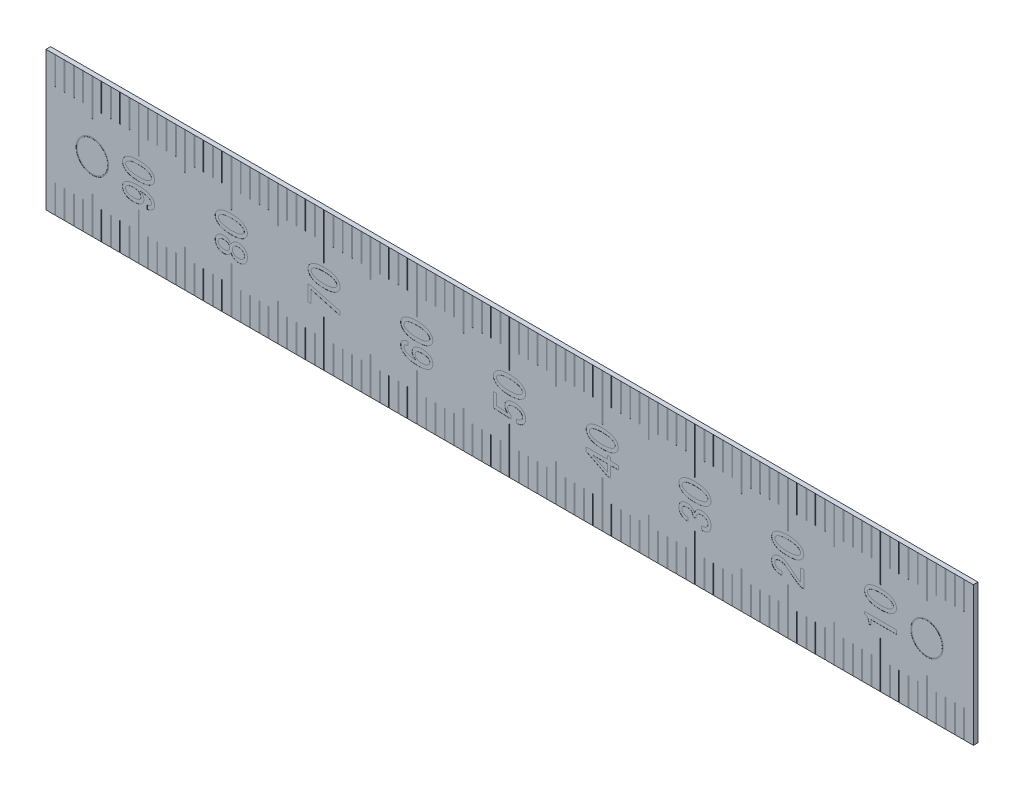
SolidWorks part; units mm, degrees
ref_plane "Front" through (0, 0, 0) normal (0, 0, 1) x (1, 0, 0)
ref_plane "Top" through (0, 0, 0) normal (0, 1, 0) x (1, 0, 0)
ref_plane "Right" through (0, 0, 0) normal (1, 0, 0) x (0, 0, -1)
sketch "Sketch1" plane through (0, 0, 0) normal (0, 0, 1) x (1, 0, 0)
  line L1 (0, -50) -> (0, 50)
  line L2 (0, -50) -> (15, -50)
  line L3 (15, -50) -> (15, 50)
  line L4 (0, 50) -> (15, 50)
  dimension "D1" = 100
  dimension "D2" = 15
extrude "Extrude1" add sketch "Sketch1" along normal blind 0.5
sketch "Sketch2" plane through (0, 0, 0.5) normal (0, 0, 1) x (1, 0, 0)
  line L0 (0, 50) -> (0, -50) construction
  line L1 (0, -50) -> (15, -50) construction
  line L2 (15, 50) -> (0, 50) construction
  circle A0 centre (7.5, -45) radius 1.75
  circle A1 centre (7.5, 45) radius 1.75
  circle A2 centre (7.5, -45) radius 1.65
  circle A3 centre (7.5, 45) radius 1.65
  dimension "D1" = 7.5
  dimension "D2" = 7.5
  dimension "D3" = 5
  dimension "D4" = 5
  dimension "D5" = 3.5
  dimension "D6" = 3.5
  dimension "D7" = 0.1
extrude "Extrude2" cut sketch "Sketch2" against normal blind 0.01
sketch "Sketch3" plane through (0, 0, 0.5) normal (0, 0, 1) x (1, 0, 0)
  line L0 (15, 50) -> (0, 50) construction
  line L1 (5.25, 28.25) -> (9.75, 28.25) construction
  line L2 (5.25, 18.25) -> (9.75, 18.25) construction
  line L3 (5.25, 8.25) -> (9.75, 8.25) construction
  line L5 (0, 50) -> (0, -50) construction
  line L6 (5.25, -1.75) -> (9.75, -1.75) construction
  line L7 (5.25, 38.25) -> (9.75, 38.25) construction
  line L8 (5.25, 38.25) -> (5.25, 41.75) construction
  line L9 (7.5, -50) -> (7.5, 50) construction
  line L10 (0, -50) -> (15, -50) construction
  line L11 (0, 40) -> (15, 40) construction
  line L12 (15, -50) -> (15, 50) construction
  line L13 (5.25, 41.75) -> (9.75, 41.75) construction
  line L14 (9.75, 38.25) -> (9.75, 41.75) construction
  line L15 (5.25, 38.25) -> (9.75, 41.75) construction
  line L16 (5.25, 41.75) -> (9.75, 38.25) construction
  line L17 (5.25, -11.75) -> (9.75, -11.75) construction
  line L18 (5.25, -21.75) -> (9.75, -21.75) construction
  line L19 (5.25, -31.75) -> (9.75, -31.75) construction
  line L20 (5.25, -41.75) -> (9.75, -41.75) construction
  circle A0 centre (7.5, 45) radius 1.75 construction
  text T0 "90" font "ＭＳ ゴシック" height 3.5
  text T1 "80" font "ＭＳ ゴシック" height 3.5
  text T2 "70" font "ＭＳ ゴシック" height 3.5
  text T3 "60" font "ＭＳ ゴシック" height 3.5
  text T4 "50  "
  text T5 "40"
  text T6 "30"
  text T7 "20"
  text T8 "10"
  point P7 (7.5, 40)
  dimension "D2" = 7.5
  dimension "D1" = 4
  dimension "D3" = 6
  dimension "D6" = 10
  dimension "D5" = 4.5
  dimension "D7" = 3.5
extrude "Extrude3" cut sketch "Sketch3" against normal blind 0.01
sketch "Sketch4" plane through (0, 0, 0.5) normal (0, 0, 1) x (1, 0, 0)
  line L0 (15, 40.05) -> (10, 40.05)
  line L1 (15, -50) -> (15, 50) construction
  line L2 (10, 40.05) -> (10, 39.95)
  line L3 (10, 39.95) -> (15, 39.95)
  line L4 (15, 39.95) -> (15, 40.05)
  line L5 (15, 50) -> (0, 50) construction
  line L6 (15, 48.05) -> (15, 47.95)
  line L7 (15, 44.95) -> (11, 44.95)
  line L8 (15, 44.95) -> (15, 45.05)
  line L9 (15, 45.05) -> (11, 45.05)
  line L10 (11, 44.95) -> (11, 45.05)
  line L11 (15, 49.05) -> (12, 49.05)
  line L12 (15, 49.05) -> (15, 48.95)
  line L13 (15, 48.95) -> (12, 48.95)
  line L14 (12, 49.05) -> (12, 48.95)
  line L15 (15, 48.05) -> (12, 48.05)
  line L16 (15, 47.95) -> (12, 47.95)
  line L17 (12, 48.05) -> (12, 47.95)
  line L18 (15, 47.05) -> (15, 46.95)
  line L19 (15, 47.05) -> (12, 47.05)
  line L20 (15, 46.95) -> (12, 46.95)
  line L21 (12, 47.05) -> (12, 46.95)
  line L22 (15, 46.05) -> (15, 45.95)
  line L23 (15, 46.05) -> (12, 46.05)
  line L24 (15, 45.95) -> (12, 45.95)
  line L25 (12, 46.05) -> (12, 45.95)
  line L26 (15, 30.05) -> (10, 30.05)
  line L27 (10, 30.05) -> (10, 29.95)
  line L28 (10, 29.95) -> (15, 29.95)
  line L29 (15, 29.95) -> (15, 30.05)
  line L30 (15, 44.05) -> (15, 43.95)
  line L31 (15, 44.05) -> (12, 44.05)
  line L32 (15, 43.95) -> (12, 43.95)
  line L33 (12, 44.05) -> (12, 43.95)
  line L34 (15, 43.05) -> (15, 42.95)
  line L35 (15, 43.05) -> (12, 43.05)
  line L36 (15, 42.95) -> (12, 42.95)
  line L37 (12, 43.05) -> (12, 42.95)
  line L38 (15, 42.05) -> (15, 41.95)
  line L39 (15, 42.05) -> (12, 42.05)
  line L40 (15, 41.95) -> (12, 41.95)
  line L41 (12, 42.05) -> (12, 41.95)
  line L42 (15, 41.05) -> (15, 40.95)
  line L43 (15, 41.05) -> (12, 41.05)
  line L44 (15, 40.95) -> (12, 40.95)
  line L45 (12, 41.05) -> (12, 40.95)
  line L46 (12, 45.05) -> (12, 44.95)
  line L47 (15, 45.05) -> (12, 45.05)
  line L48 (15, 44.95) -> (12, 44.95)
  line L49 (15, 45.05) -> (15, 44.95)
  line L50 (15, 38.05) -> (15, 37.95)
  line L51 (15, 34.95) -> (11, 34.95)
  line L52 (15, 34.95) -> (15, 35.05)
  line L53 (15, 35.05) -> (11, 35.05)
  line L54 (11, 34.95) -> (11, 35.05)
  line L55 (15, 39.05) -> (12, 39.05)
  line L56 (15, 39.05) -> (15, 38.95)
  line L57 (15, 38.95) -> (12, 38.95)
  line L58 (12, 39.05) -> (12, 38.95)
  line L59 (15, 38.05) -> (12, 38.05)
  line L60 (15, 37.95) -> (12, 37.95)
  line L61 (12, 38.05) -> (12, 37.95)
  line L62 (15, 37.05) -> (15, 36.95)
  line L63 (15, 37.05) -> (12, 37.05)
  line L64 (15, 36.95) -> (12, 36.95)
  line L65 (12, 37.05) -> (12, 36.95)
  line L66 (15, 36.05) -> (15, 35.95)
  line L67 (15, 36.05) -> (12, 36.05)
  line L68 (15, 35.95) -> (12, 35.95)
  line L69 (12, 36.05) -> (12, 35.95)
  line L70 (15, 34.05) -> (15, 33.95)
  line L71 (15, 34.05) -> (12, 34.05)
  line L72 (15, 33.95) -> (12, 33.95)
  line L73 (12, 34.05) -> (12, 33.95)
  line L74 (15, 33.05) -> (15, 32.95)
  line L75 (15, 33.05) -> (12, 33.05)
  line L76 (15, 32.95) -> (12, 32.95)
  line L77 (12, 33.05) -> (12, 32.95)
  line L78 (15, 32.05) -> (15, 31.95)
  line L79 (15, 32.05) -> (12, 32.05)
  line L80 (15, 31.95) -> (12, 31.95)
  line L81 (12, 32.05) -> (12, 31.95)
  line L82 (15, 31.05) -> (15, 30.95)
  line L83 (15, 31.05) -> (12, 31.05)
  line L84 (15, 30.95) -> (12, 30.95)
  line L85 (12, 31.05) -> (12, 30.95)
  line L86 (15, 20.05) -> (10, 20.05)
  line L87 (10, 20.05) -> (10, 19.95)
  line L88 (10, 19.95) -> (15, 19.95)
  line L89 (15, 19.95) -> (15, 20.05)
  line L90 (15, 28.05) -> (15, 27.95)
  line L91 (15, 24.95) -> (11, 24.95)
  line L92 (15, 24.95) -> (15, 25.05)
  line L93 (15, 25.05) -> (11, 25.05)
  line L94 (11, 24.95) -> (11, 25.05)
  line L95 (15, 29.05) -> (12, 29.05)
  line L96 (15, 29.05) -> (15, 28.95)
  line L97 (15, 28.95) -> (12, 28.95)
  line L98 (12, 29.05) -> (12, 28.95)
  line L99 (15, 28.05) -> (12, 28.05)
  line L100 (15, 27.95) -> (12, 27.95)
  line L101 (12, 28.05) -> (12, 27.95)
  line L102 (15, 27.05) -> (15, 26.95)
  line L103 (15, 27.05) -> (12, 27.05)
  line L104 (15, 26.95) -> (12, 26.95)
  line L105 (12, 27.05) -> (12, 26.95)
  line L106 (15, 26.05) -> (15, 25.95)
  line L107 (15, 26.05) -> (12, 26.05)
  line L108 (15, 25.95) -> (12, 25.95)
  line L109 (12, 26.05) -> (12, 25.95)
  line L110 (15, 24.05) -> (15, 23.95)
  line L111 (15, 24.05) -> (12, 24.05)
  line L112 (15, 23.95) -> (12, 23.95)
  line L113 (12, 24.05) -> (12, 23.95)
  line L114 (15, 23.05) -> (15, 22.95)
  line L115 (15, 23.05) -> (12, 23.05)
  line L116 (15, 22.95) -> (12, 22.95)
  line L117 (12, 23.05) -> (12, 22.95)
  line L118 (15, 22.05) -> (15, 21.95)
  line L119 (15, 22.05) -> (12, 22.05)
  line L120 (15, 21.95) -> (12, 21.95)
  line L121 (12, 22.05) -> (12, 21.95)
  line L122 (15, 21.05) -> (15, 20.95)
  line L123 (15, 21.05) -> (12, 21.05)
  line L124 (15, 20.95) -> (12, 20.95)
  line L125 (12, 21.05) -> (12, 20.95)
  line L126 (15, 10.05) -> (10, 10.05)
  line L127 (10, 10.05) -> (10, 9.95)
  line L128 (10, 9.95) -> (15, 9.95)
  line L129 (15, 9.95) -> (15, 10.05)
  line L130 (15, 18.05) -> (15, 17.95)
  line L131 (15, 14.95) -> (11, 14.95)
  line L132 (15, 14.95) -> (15, 15.05)
  line L133 (15, 15.05) -> (11, 15.05)
  line L134 (11, 14.95) -> (11, 15.05)
  line L135 (15, 19.05) -> (12, 19.05)
  line L136 (15, 19.05) -> (15, 18.95)
  line L137 (15, 18.95) -> (12, 18.95)
  line L138 (12, 19.05) -> (12, 18.95)
  line L139 (15, 18.05) -> (12, 18.05)
  line L140 (15, 17.95) -> (12, 17.95)
  line L141 (12, 18.05) -> (12, 17.95)
  line L142 (15, 17.05) -> (15, 16.95)
  line L143 (15, 17.05) -> (12, 17.05)
  line L144 (15, 16.95) -> (12, 16.95)
  line L145 (12, 17.05) -> (12, 16.95)
  line L146 (15, 16.05) -> (15, 15.95)
  line L147 (15, 16.05) -> (12, 16.05)
  line L148 (15, 15.95) -> (12, 15.95)
  line L149 (12, 16.05) -> (12, 15.95)
  line L150 (15, 14.05) -> (15, 13.95)
  line L151 (15, 14.05) -> (12, 14.05)
  line L152 (15, 13.95) -> (12, 13.95)
  line L153 (12, 14.05) -> (12, 13.95)
  line L154 (15, 13.05) -> (15, 12.95)
  line L155 (15, 13.05) -> (12, 13.05)
  line L156 (15, 12.95) -> (12, 12.95)
  line L157 (12, 13.05) -> (12, 12.95)
  line L158 (15, 12.05) -> (15, 11.95)
  line L159 (15, 12.05) -> (12, 12.05)
  line L160 (15, 11.95) -> (12, 11.95)
  line L161 (12, 12.05) -> (12, 11.95)
  line L162 (15, 11.05) -> (15, 10.95)
  line L163 (15, 11.05) -> (12, 11.05)
  line L164 (15, 10.95) -> (12, 10.95)
  line L165 (12, 11.05) -> (12, 10.95)
  line L166 (7.5, 50) -> (7.5, 36.693) construction
  line L167 (3, 1.05) -> (3, 0.95)
  line L168 (0, 0.95) -> (3, 0.95)
  line L169 (0, 1.05) -> (3, 1.05)
  line L170 (15, 8.05) -> (15, 7.95)
  line L171 (15, 4.95) -> (11, 4.95)
  line L172 (15, 4.95) -> (15, 5.05)
  line L173 (15, 5.05) -> (11, 5.05)
  line L174 (11, 4.95) -> (11, 5.05)
  line L175 (15, 9.05) -> (12, 9.05)
  line L176 (15, 9.05) -> (15, 8.95)
  line L177 (15, 8.95) -> (12, 8.95)
  line L178 (12, 9.05) -> (12, 8.95)
  line L179 (15, 8.05) -> (12, 8.05)
  line L180 (15, 7.95) -> (12, 7.95)
  line L181 (12, 8.05) -> (12, 7.95)
  line L182 (15, 7.05) -> (15, 6.95)
  line L183 (15, 7.05) -> (12, 7.05)
  line L184 (15, 6.95) -> (12, 6.95)
  line L185 (12, 7.05) -> (12, 6.95)
  line L186 (15, 6.05) -> (15, 5.95)
  line L187 (15, 6.05) -> (12, 6.05)
  line L188 (15, 5.95) -> (12, 5.95)
  line L189 (12, 6.05) -> (12, 5.95)
  line L190 (15, 4.05) -> (15, 3.95)
  line L191 (15, 4.05) -> (12, 4.05)
  line L192 (15, 3.95) -> (12, 3.95)
  line L193 (12, 4.05) -> (12, 3.95)
  line L194 (15, 3.05) -> (15, 2.95)
  line L195 (15, 3.05) -> (12, 3.05)
  line L196 (15, 2.95) -> (12, 2.95)
  line L197 (12, 3.05) -> (12, 2.95)
  line L198 (15, 2.05) -> (15, 1.95)
  line L199 (15, 2.05) -> (12, 2.05)
  line L200 (15, 1.95) -> (12, 1.95)
  line L201 (12, 2.05) -> (12, 1.95)
  line L202 (15, 1.05) -> (15, 0.95)
  line L203 (15, 1.05) -> (12, 1.05)
  line L204 (15, 0.95) -> (12, 0.95)
  line L205 (12, 1.05) -> (12, 0.95)
  line L206 (15, 0.05) -> (10, 0.05)
  line L207 (10, 0.05) -> (10, -0.05)
  line L208 (10, -0.05) -> (15, -0.05)
  line L209 (15, -0.05) -> (15, 0.05)
  line L210 (0, 1.05) -> (0, 0.95)
  line L211 (3, 2.05) -> (3, 1.95)
  line L212 (0, 1.95) -> (3, 1.95)
  line L213 (0, 2.05) -> (3, 2.05)
  line L214 (0, 2.05) -> (0, 1.95)
  line L215 (3, 3.05) -> (3, 2.95)
  line L216 (0, 2.95) -> (3, 2.95)
  line L217 (0, 3.05) -> (3, 3.05)
  line L218 (0, 3.05) -> (0, 2.95)
  line L219 (3, 4.05) -> (3, 3.95)
  line L220 (0, 3.95) -> (3, 3.95)
  line L221 (0, 4.05) -> (3, 4.05)
  line L222 (0, 4.05) -> (0, 3.95)
  line L223 (3, 6.05) -> (3, 5.95)
  line L224 (0, 5.95) -> (3, 5.95)
  line L225 (0, 6.05) -> (3, 6.05)
  line L226 (0, 6.05) -> (0, 5.95)
  line L227 (3, 7.05) -> (3, 6.95)
  line L228 (0, 6.95) -> (3, 6.95)
  line L229 (0, 7.05) -> (3, 7.05)
  line L230 (0, 7.05) -> (0, 6.95)
  line L231 (3, 8.05) -> (3, 7.95)
  line L232 (0, 7.95) -> (3, 7.95)
  line L233 (0, 8.05) -> (3, 8.05)
  line L234 (3, 9.05) -> (3, 8.95)
  line L235 (0, 8.95) -> (3, 8.95)
  line L236 (0, 9.05) -> (0, 8.95)
  line L237 (0, 9.05) -> (3, 9.05)
  line L238 (4, 4.95) -> (4, 5.05)
  line L239 (0, 5.05) -> (4, 5.05)
  line L240 (0, 4.95) -> (0, 5.05)
  line L241 (0, 4.95) -> (4, 4.95)
  line L242 (0, 8.05) -> (0, 7.95)
  line L243 (3, 11.05) -> (3, 10.95)
  line L244 (0, 10.95) -> (3, 10.95)
  line L245 (0, 11.05) -> (3, 11.05)
  line L246 (0, 11.05) -> (0, 10.95)
  line L247 (3, 12.05) -> (3, 11.95)
  line L248 (0, 11.95) -> (3, 11.95)
  line L249 (0, 12.05) -> (3, 12.05)
  line L250 (0, 12.05) -> (0, 11.95)
  line L251 (3, 13.05) -> (3, 12.95)
  line L252 (0, 12.95) -> (3, 12.95)
  line L253 (0, 13.05) -> (3, 13.05)
  line L254 (0, 13.05) -> (0, 12.95)
  line L255 (3, 14.05) -> (3, 13.95)
  line L256 (0, 13.95) -> (3, 13.95)
  line L257 (0, 14.05) -> (3, 14.05)
  line L258 (0, 14.05) -> (0, 13.95)
  line L259 (3, 16.05) -> (3, 15.95)
  line L260 (0, 15.95) -> (3, 15.95)
  line L261 (0, 16.05) -> (3, 16.05)
  line L262 (0, 16.05) -> (0, 15.95)
  line L263 (3, 17.05) -> (3, 16.95)
  line L264 (0, 16.95) -> (3, 16.95)
  line L265 (0, 17.05) -> (3, 17.05)
  line L266 (0, 17.05) -> (0, 16.95)
  line L267 (3, 18.05) -> (3, 17.95)
  line L268 (0, 17.95) -> (3, 17.95)
  line L269 (0, 18.05) -> (3, 18.05)
  line L270 (3, 19.05) -> (3, 18.95)
  line L271 (0, 18.95) -> (3, 18.95)
  line L272 (0, 19.05) -> (0, 18.95)
  line L273 (0, 19.05) -> (3, 19.05)
  line L274 (4, 14.95) -> (4, 15.05)
  line L275 (0, 15.05) -> (4, 15.05)
  line L276 (0, 14.95) -> (0, 15.05)
  line L277 (0, 14.95) -> (4, 14.95)
  line L278 (0, 18.05) -> (0, 17.95)
  line L279 (0, 9.95) -> (0, 10.05)
  line L280 (5, 9.95) -> (0, 9.95)
  line L281 (5, 10.05) -> (5, 9.95)
  line L282 (0, 10.05) -> (5, 10.05)
  line L283 (3, 21.05) -> (3, 20.95)
  line L284 (0, 20.95) -> (3, 20.95)
  line L285 (0, 21.05) -> (3, 21.05)
  line L286 (0, 21.05) -> (0, 20.95)
  line L287 (3, 22.05) -> (3, 21.95)
  line L288 (0, 21.95) -> (3, 21.95)
  line L289 (0, 22.05) -> (3, 22.05)
  line L290 (0, 22.05) -> (0, 21.95)
  line L291 (3, 23.05) -> (3, 22.95)
  line L292 (0, 22.95) -> (3, 22.95)
  line L293 (0, 23.05) -> (3, 23.05)
  line L294 (0, 23.05) -> (0, 22.95)
  line L295 (3, 24.05) -> (3, 23.95)
  line L296 (0, 23.95) -> (3, 23.95)
  line L297 (0, 24.05) -> (3, 24.05)
  line L298 (0, 24.05) -> (0, 23.95)
  line L299 (3, 26.05) -> (3, 25.95)
  line L300 (0, 25.95) -> (3, 25.95)
  line L301 (0, 26.05) -> (3, 26.05)
  line L302 (0, 26.05) -> (0, 25.95)
  line L303 (3, 27.05) -> (3, 26.95)
  line L304 (0, 26.95) -> (3, 26.95)
  line L305 (0, 27.05) -> (3, 27.05)
  line L306 (0, 27.05) -> (0, 26.95)
  line L307 (3, 28.05) -> (3, 27.95)
  line L308 (0, 27.95) -> (3, 27.95)
  line L309 (0, 28.05) -> (3, 28.05)
  line L310 (3, 29.05) -> (3, 28.95)
  line L311 (0, 28.95) -> (3, 28.95)
  line L312 (0, 29.05) -> (0, 28.95)
  line L313 (0, 29.05) -> (3, 29.05)
  line L314 (4, 24.95) -> (4, 25.05)
  line L315 (0, 25.05) -> (4, 25.05)
  line L316 (0, 24.95) -> (0, 25.05)
  line L317 (0, 24.95) -> (4, 24.95)
  line L318 (0, 28.05) -> (0, 27.95)
  line L319 (0, 19.95) -> (0, 20.05)
  line L320 (5, 19.95) -> (0, 19.95)
  line L321 (5, 20.05) -> (5, 19.95)
  line L322 (0, 20.05) -> (5, 20.05)
  line L323 (3, 31.05) -> (3, 30.95)
  line L324 (0, 30.95) -> (3, 30.95)
  line L325 (0, 31.05) -> (3, 31.05)
  line L326 (0, 31.05) -> (0, 30.95)
  line L327 (3, 32.05) -> (3, 31.95)
  line L328 (0, 31.95) -> (3, 31.95)
  line L329 (0, 32.05) -> (3, 32.05)
  line L330 (0, 32.05) -> (0, 31.95)
  line L331 (3, 33.05) -> (3, 32.95)
  line L332 (0, 32.95) -> (3, 32.95)
  line L333 (0, 33.05) -> (3, 33.05)
  line L334 (0, 33.05) -> (0, 32.95)
  line L335 (3, 34.05) -> (3, 33.95)
  line L336 (0, 33.95) -> (3, 33.95)
  line L337 (0, 34.05) -> (3, 34.05)
  line L338 (0, 34.05) -> (0, 33.95)
  line L339 (3, 36.05) -> (3, 35.95)
  line L340 (0, 35.95) -> (3, 35.95)
  line L341 (0, 36.05) -> (3, 36.05)
  line L342 (0, 36.05) -> (0, 35.95)
  line L343 (3, 37.05) -> (3, 36.95)
  line L344 (0, 36.95) -> (3, 36.95)
  line L345 (0, 37.05) -> (3, 37.05)
  line L346 (0, 37.05) -> (0, 36.95)
  line L347 (3, 38.05) -> (3, 37.95)
  line L348 (0, 37.95) -> (3, 37.95)
  line L349 (0, 38.05) -> (3, 38.05)
  line L350 (3, 39.05) -> (3, 38.95)
  line L351 (0, 38.95) -> (3, 38.95)
  line L352 (0, 39.05) -> (0, 38.95)
  line L353 (0, 39.05) -> (3, 39.05)
  line L354 (4, 34.95) -> (4, 35.05)
  line L355 (0, 35.05) -> (4, 35.05)
  line L356 (0, 34.95) -> (0, 35.05)
  line L357 (0, 34.95) -> (4, 34.95)
  line L358 (0, 38.05) -> (0, 37.95)
  line L359 (3, 41.05) -> (3, 40.95)
  line L360 (0, 40.95) -> (3, 40.95)
  line L361 (0, 41.05) -> (3, 41.05)
  line L362 (0, 41.05) -> (0, 40.95)
  line L363 (3, 42.05) -> (3, 41.95)
  line L364 (0, 41.95) -> (3, 41.95)
  line L365 (0, 42.05) -> (3, 42.05)
  line L366 (0, 42.05) -> (0, 41.95)
  line L367 (3, 43.05) -> (3, 42.95)
  line L368 (0, 42.95) -> (3, 42.95)
  line L369 (0, 43.05) -> (3, 43.05)
  line L370 (0, 43.05) -> (0, 42.95)
  line L371 (3, 44.05) -> (3, 43.95)
  line L372 (0, 43.95) -> (3, 43.95)
  line L373 (0, 44.05) -> (3, 44.05)
  line L374 (0, 44.05) -> (0, 43.95)
  line L375 (0, 29.95) -> (0, 30.05)
  line L376 (5, 29.95) -> (0, 29.95)
  line L377 (5, 30.05) -> (5, 29.95)
  line L378 (0, 30.05) -> (5, 30.05)
  line L379 (3, 46.05) -> (3, 45.95)
  line L380 (0, 45.95) -> (3, 45.95)
  line L381 (0, 46.05) -> (3, 46.05)
  line L382 (0, 46.05) -> (0, 45.95)
  line L383 (3, 47.05) -> (3, 46.95)
  line L384 (0, 46.95) -> (3, 46.95)
  line L385 (0, 47.05) -> (3, 47.05)
  line L386 (0, 47.05) -> (0, 46.95)
  line L387 (3, 48.05) -> (3, 47.95)
  line L388 (0, 47.95) -> (3, 47.95)
  line L389 (0, 48.05) -> (3, 48.05)
  line L390 (3, 49.05) -> (3, 48.95)
  line L391 (0, 48.95) -> (3, 48.95)
  line L392 (0, 49.05) -> (0, 48.95)
  line L393 (0, 49.05) -> (3, 49.05)
  line L394 (4, 44.95) -> (4, 45.05)
  line L395 (0, 45.05) -> (4, 45.05)
  line L396 (0, 44.95) -> (0, 45.05)
  line L397 (0, 44.95) -> (4, 44.95)
  line L398 (0, 48.05) -> (0, 47.95)
  line L399 (0, 39.95) -> (0, 40.05)
  line L400 (5, 39.95) -> (0, 39.95)
  line L401 (5, 40.05) -> (5, 39.95)
  line L402 (0, 40.05) -> (5, 40.05)
  line L403 (15, 0.05) -> (10, 0.05)
  line L404 (10, 0.05) -> (10, -0.05)
  line L405 (10, -0.05) -> (15, -0.05)
  line L406 (15, -0.05) -> (15, 0.05)
  line L407 (3, -8.95) -> (3, -9.05)
  line L408 (0, -9.05) -> (3, -9.05)
  line L409 (0, -8.95) -> (3, -8.95)
  line L410 (15, -1.95) -> (15, -2.05)
  line L411 (15, -5.05) -> (11, -5.05)
  line L412 (15, -5.05) -> (15, -4.95)
  line L413 (15, -4.95) -> (11, -4.95)
  line L414 (11, -5.05) -> (11, -4.95)
  line L415 (15, -0.95) -> (12, -0.95)
  line L416 (15, -0.95) -> (15, -1.05)
  line L417 (15, -1.05) -> (12, -1.05)
  line L418 (12, -0.95) -> (12, -1.05)
  line L419 (15, -1.95) -> (12, -1.95)
  line L420 (15, -2.05) -> (12, -2.05)
  line L421 (12, -1.95) -> (12, -2.05)
  line L422 (15, -2.95) -> (15, -3.05)
  line L423 (15, -2.95) -> (12, -2.95)
  line L424 (15, -3.05) -> (12, -3.05)
  line L425 (12, -2.95) -> (12, -3.05)
  line L426 (15, -3.95) -> (15, -4.05)
  line L427 (15, -3.95) -> (12, -3.95)
  line L428 (15, -4.05) -> (12, -4.05)
  line L429 (12, -3.95) -> (12, -4.05)
  line L430 (15, -5.95) -> (15, -6.05)
  line L431 (15, -5.95) -> (12, -5.95)
  line L432 (15, -6.05) -> (12, -6.05)
  line L433 (12, -5.95) -> (12, -6.05)
  line L434 (15, -6.95) -> (15, -7.05)
  line L435 (15, -6.95) -> (12, -6.95)
  line L436 (15, -7.05) -> (12, -7.05)
  line L437 (12, -6.95) -> (12, -7.05)
  line L438 (15, -7.95) -> (15, -8.05)
  line L439 (15, -7.95) -> (12, -7.95)
  line L440 (15, -8.05) -> (12, -8.05)
  line L441 (12, -7.95) -> (12, -8.05)
  line L442 (15, -8.95) -> (15, -9.05)
  line L443 (15, -8.95) -> (12, -8.95)
  line L444 (15, -9.05) -> (12, -9.05)
  line L445 (12, -8.95) -> (12, -9.05)
  line L446 (0, -8.95) -> (0, -9.05)
  line L447 (3, -7.95) -> (3, -8.05)
  line L448 (0, -8.05) -> (3, -8.05)
  line L449 (0, -7.95) -> (3, -7.95)
  line L450 (0, -7.95) -> (0, -8.05)
  line L451 (3, -6.95) -> (3, -7.05)
  line L452 (0, -7.05) -> (3, -7.05)
  line L453 (0, -6.95) -> (3, -6.95)
  line L454 (0, -6.95) -> (0, -7.05)
  line L455 (3, -5.95) -> (3, -6.05)
  line L456 (0, -6.05) -> (3, -6.05)
  line L457 (0, -5.95) -> (3, -5.95)
  line L458 (0, -5.95) -> (0, -6.05)
  line L459 (3, -3.95) -> (3, -4.05)
  line L460 (0, -4.05) -> (3, -4.05)
  line L461 (0, -3.95) -> (3, -3.95)
  line L462 (0, -3.95) -> (0, -4.05)
  line L463 (3, -2.95) -> (3, -3.05)
  line L464 (0, -3.05) -> (3, -3.05)
  line L465 (0, -2.95) -> (3, -2.95)
  line L466 (0, -2.95) -> (0, -3.05)
  line L467 (3, -1.95) -> (3, -2.05)
  line L468 (0, -2.05) -> (3, -2.05)
  line L469 (0, -1.95) -> (3, -1.95)
  line L470 (3, -0.95) -> (3, -1.05)
  line L471 (0, -1.05) -> (3, -1.05)
  line L472 (0, -0.95) -> (0, -1.05)
  line L473 (0, -0.95) -> (3, -0.95)
  line L474 (4, -5.05) -> (4, -4.95)
  line L475 (0, -4.95) -> (4, -4.95)
  line L476 (0, -5.05) -> (0, -4.95)
  line L477 (0, -5.05) -> (4, -5.05)
  line L478 (0, -1.95) -> (0, -2.05)
  line L479 (0, -0.05) -> (0, 0.05)
  line L480 (5, -0.05) -> (0, -0.05)
  line L481 (5, 0.05) -> (5, -0.05)
  line L482 (0, 0.05) -> (5, 0.05)
  line L483 (15, -9.95) -> (10, -9.95)
  line L484 (10, -9.95) -> (10, -10.05)
  line L485 (10, -10.05) -> (15, -10.05)
  line L486 (15, -10.05) -> (15, -9.95)
  line L487 (3, -18.95) -> (3, -19.05)
  line L488 (0, -19.05) -> (3, -19.05)
  line L489 (0, -18.95) -> (3, -18.95)
  line L490 (15, -11.95) -> (15, -12.05)
  line L491 (15, -15.05) -> (11, -15.05)
  line L492 (15, -15.05) -> (15, -14.95)
  line L493 (15, -14.95) -> (11, -14.95)
  line L494 (11, -15.05) -> (11, -14.95)
  line L495 (15, -10.95) -> (12, -10.95)
  line L496 (15, -10.95) -> (15, -11.05)
  line L497 (15, -11.05) -> (12, -11.05)
  line L498 (12, -10.95) -> (12, -11.05)
  line L499 (15, -11.95) -> (12, -11.95)
  line L500 (15, -12.05) -> (12, -12.05)
  line L501 (12, -11.95) -> (12, -12.05)
  line L502 (15, -12.95) -> (15, -13.05)
  line L503 (15, -12.95) -> (12, -12.95)
  line L504 (15, -13.05) -> (12, -13.05)
  line L505 (12, -12.95) -> (12, -13.05)
  line L506 (15, -13.95) -> (15, -14.05)
  line L507 (15, -13.95) -> (12, -13.95)
  line L508 (15, -14.05) -> (12, -14.05)
  line L509 (12, -13.95) -> (12, -14.05)
  line L510 (15, -15.95) -> (15, -16.05)
  line L511 (15, -15.95) -> (12, -15.95)
  line L512 (15, -16.05) -> (12, -16.05)
  line L513 (12, -15.95) -> (12, -16.05)
  line L514 (15, -16.95) -> (15, -17.05)
  line L515 (15, -16.95) -> (12, -16.95)
  line L516 (15, -17.05) -> (12, -17.05)
  line L517 (12, -16.95) -> (12, -17.05)
  line L518 (15, -17.95) -> (15, -18.05)
  line L519 (15, -17.95) -> (12, -17.95)
  line L520 (15, -18.05) -> (12, -18.05)
  line L521 (12, -17.95) -> (12, -18.05)
  line L522 (15, -18.95) -> (15, -19.05)
  line L523 (15, -18.95) -> (12, -18.95)
  line L524 (15, -19.05) -> (12, -19.05)
  line L525 (12, -18.95) -> (12, -19.05)
  line L526 (0, -18.95) -> (0, -19.05)
  line L527 (3, -17.95) -> (3, -18.05)
  line L528 (0, -18.05) -> (3, -18.05)
  line L529 (0, -17.95) -> (3, -17.95)
  line L530 (0, -17.95) -> (0, -18.05)
  line L531 (3, -16.95) -> (3, -17.05)
  line L532 (0, -17.05) -> (3, -17.05)
  line L533 (0, -16.95) -> (3, -16.95)
  line L534 (0, -16.95) -> (0, -17.05)
  line L535 (3, -15.95) -> (3, -16.05)
  line L536 (0, -16.05) -> (3, -16.05)
  line L537 (0, -15.95) -> (3, -15.95)
  line L538 (0, -15.95) -> (0, -16.05)
  line L539 (3, -13.95) -> (3, -14.05)
  line L540 (0, -14.05) -> (3, -14.05)
  line L541 (0, -13.95) -> (3, -13.95)
  line L542 (0, -13.95) -> (0, -14.05)
  line L543 (3, -12.95) -> (3, -13.05)
  line L544 (0, -13.05) -> (3, -13.05)
  line L545 (0, -12.95) -> (3, -12.95)
  line L546 (0, -12.95) -> (0, -13.05)
  line L547 (3, -11.95) -> (3, -12.05)
  line L548 (0, -12.05) -> (3, -12.05)
  line L549 (0, -11.95) -> (3, -11.95)
  line L550 (3, -10.95) -> (3, -11.05)
  line L551 (0, -11.05) -> (3, -11.05)
  line L552 (0, -10.95) -> (0, -11.05)
  line L553 (0, -10.95) -> (3, -10.95)
  line L554 (4, -15.05) -> (4, -14.95)
  line L555 (0, -14.95) -> (4, -14.95)
  line L556 (0, -15.05) -> (0, -14.95)
  line L557 (0, -15.05) -> (4, -15.05)
  line L558 (0, -11.95) -> (0, -12.05)
  line L559 (0, -10.05) -> (0, -9.95)
  line L560 (5, -10.05) -> (0, -10.05)
  line L561 (5, -9.95) -> (5, -10.05)
  line L562 (0, -9.95) -> (5, -9.95)
  line L563 (15, -19.95) -> (10, -19.95)
  line L564 (10, -19.95) -> (10, -20.05)
  line L565 (10, -20.05) -> (15, -20.05)
  line L566 (15, -20.05) -> (15, -19.95)
  line L567 (3, -28.95) -> (3, -29.05)
  line L568 (0, -29.05) -> (3, -29.05)
  line L569 (0, -28.95) -> (3, -28.95)
  line L570 (15, -21.95) -> (15, -22.05)
  line L571 (15, -25.05) -> (11, -25.05)
  line L572 (15, -25.05) -> (15, -24.95)
  line L573 (15, -24.95) -> (11, -24.95)
  line L574 (11, -25.05) -> (11, -24.95)
  line L575 (15, -20.95) -> (12, -20.95)
  line L576 (15, -20.95) -> (15, -21.05)
  line L577 (15, -21.05) -> (12, -21.05)
  line L578 (12, -20.95) -> (12, -21.05)
  line L579 (15, -21.95) -> (12, -21.95)
  line L580 (15, -22.05) -> (12, -22.05)
  line L581 (12, -21.95) -> (12, -22.05)
  line L582 (15, -22.95) -> (15, -23.05)
  line L583 (15, -22.95) -> (12, -22.95)
  line L584 (15, -23.05) -> (12, -23.05)
  line L585 (12, -22.95) -> (12, -23.05)
  line L586 (15, -23.95) -> (15, -24.05)
  line L587 (15, -23.95) -> (12, -23.95)
  line L588 (15, -24.05) -> (12, -24.05)
  line L589 (12, -23.95) -> (12, -24.05)
  line L590 (15, -25.95) -> (15, -26.05)
  line L591 (15, -25.95) -> (12, -25.95)
  line L592 (15, -26.05) -> (12, -26.05)
  line L593 (12, -25.95) -> (12, -26.05)
  line L594 (15, -26.95) -> (15, -27.05)
  line L595 (15, -26.95) -> (12, -26.95)
  line L596 (15, -27.05) -> (12, -27.05)
  line L597 (12, -26.95) -> (12, -27.05)
  line L598 (15, -27.95) -> (15, -28.05)
  line L599 (15, -27.95) -> (12, -27.95)
  line L600 (15, -28.05) -> (12, -28.05)
  line L601 (12, -27.95) -> (12, -28.05)
  line L602 (15, -28.95) -> (15, -29.05)
  line L603 (15, -28.95) -> (12, -28.95)
  line L604 (15, -29.05) -> (12, -29.05)
  line L605 (12, -28.95) -> (12, -29.05)
  line L606 (0, -28.95) -> (0, -29.05)
  line L607 (3, -27.95) -> (3, -28.05)
  line L608 (0, -28.05) -> (3, -28.05)
  line L609 (0, -27.95) -> (3, -27.95)
  line L610 (0, -27.95) -> (0, -28.05)
  line L611 (3, -26.95) -> (3, -27.05)
  line L612 (0, -27.05) -> (3, -27.05)
  line L613 (0, -26.95) -> (3, -26.95)
  line L614 (0, -26.95) -> (0, -27.05)
  line L615 (3, -25.95) -> (3, -26.05)
  line L616 (0, -26.05) -> (3, -26.05)
  line L617 (0, -25.95) -> (3, -25.95)
  line L618 (0, -25.95) -> (0, -26.05)
  line L619 (3, -23.95) -> (3, -24.05)
  line L620 (0, -24.05) -> (3, -24.05)
  line L621 (0, -23.95) -> (3, -23.95)
  line L622 (0, -23.95) -> (0, -24.05)
  line L623 (3, -22.95) -> (3, -23.05)
  line L624 (0, -23.05) -> (3, -23.05)
  line L625 (0, -22.95) -> (3, -22.95)
  line L626 (0, -22.95) -> (0, -23.05)
  line L627 (3, -21.95) -> (3, -22.05)
  line L628 (0, -22.05) -> (3, -22.05)
  line L629 (0, -21.95) -> (3, -21.95)
  line L630 (3, -20.95) -> (3, -21.05)
  line L631 (0, -21.05) -> (3, -21.05)
  line L632 (0, -20.95) -> (0, -21.05)
  line L633 (0, -20.95) -> (3, -20.95)
  line L634 (4, -25.05) -> (4, -24.95)
  line L635 (0, -24.95) -> (4, -24.95)
  line L636 (0, -25.05) -> (0, -24.95)
  line L637 (0, -25.05) -> (4, -25.05)
  line L638 (0, -21.95) -> (0, -22.05)
  line L639 (0, -20.05) -> (0, -19.95)
  line L640 (5, -20.05) -> (0, -20.05)
  line L641 (5, -19.95) -> (5, -20.05)
  line L642 (0, -19.95) -> (5, -19.95)
  line L643 (15, -29.95) -> (10, -29.95)
  line L644 (10, -29.95) -> (10, -30.05)
  line L645 (10, -30.05) -> (15, -30.05)
  line L646 (15, -30.05) -> (15, -29.95)
  line L647 (3, -38.95) -> (3, -39.05)
  line L648 (0, -39.05) -> (3, -39.05)
  line L649 (0, -38.95) -> (3, -38.95)
  line L650 (15, -31.95) -> (15, -32.05)
  line L651 (15, -35.05) -> (11, -35.05)
  line L652 (15, -35.05) -> (15, -34.95)
  line L653 (15, -34.95) -> (11, -34.95)
  line L654 (11, -35.05) -> (11, -34.95)
  line L655 (15, -30.95) -> (12, -30.95)
  line L656 (15, -30.95) -> (15, -31.05)
  line L657 (15, -31.05) -> (12, -31.05)
  line L658 (12, -30.95) -> (12, -31.05)
  line L659 (15, -31.95) -> (12, -31.95)
  line L660 (15, -32.05) -> (12, -32.05)
  line L661 (12, -31.95) -> (12, -32.05)
  line L662 (15, -32.95) -> (15, -33.05)
  line L663 (15, -32.95) -> (12, -32.95)
  line L664 (15, -33.05) -> (12, -33.05)
  line L665 (12, -32.95) -> (12, -33.05)
  line L666 (15, -33.95) -> (15, -34.05)
  line L667 (15, -33.95) -> (12, -33.95)
  line L668 (15, -34.05) -> (12, -34.05)
  line L669 (12, -33.95) -> (12, -34.05)
  line L670 (15, -35.95) -> (15, -36.05)
  line L671 (15, -35.95) -> (12, -35.95)
  line L672 (15, -36.05) -> (12, -36.05)
  line L673 (12, -35.95) -> (12, -36.05)
  line L674 (15, -36.95) -> (15, -37.05)
  line L675 (15, -36.95) -> (12, -36.95)
  line L676 (15, -37.05) -> (12, -37.05)
  line L677 (12, -36.95) -> (12, -37.05)
  line L678 (15, -37.95) -> (15, -38.05)
  line L679 (15, -37.95) -> (12, -37.95)
  line L680 (15, -38.05) -> (12, -38.05)
  line L681 (12, -37.95) -> (12, -38.05)
  line L682 (15, -38.95) -> (15, -39.05)
  line L683 (15, -38.95) -> (12, -38.95)
  line L684 (15, -39.05) -> (12, -39.05)
  line L685 (12, -38.95) -> (12, -39.05)
  line L686 (0, -38.95) -> (0, -39.05)
  line L687 (3, -37.95) -> (3, -38.05)
  line L688 (0, -38.05) -> (3, -38.05)
  line L689 (0, -37.95) -> (3, -37.95)
  line L690 (0, -37.95) -> (0, -38.05)
  line L691 (3, -36.95) -> (3, -37.05)
  line L692 (0, -37.05) -> (3, -37.05)
  line L693 (0, -36.95) -> (3, -36.95)
  line L694 (0, -36.95) -> (0, -37.05)
  line L695 (3, -35.95) -> (3, -36.05)
  line L696 (0, -36.05) -> (3, -36.05)
  line L697 (0, -35.95) -> (3, -35.95)
  line L698 (0, -35.95) -> (0, -36.05)
  line L699 (3, -33.95) -> (3, -34.05)
  line L700 (0, -34.05) -> (3, -34.05)
  line L701 (0, -33.95) -> (3, -33.95)
  line L702 (0, -33.95) -> (0, -34.05)
  line L703 (3, -32.95) -> (3, -33.05)
  line L704 (0, -33.05) -> (3, -33.05)
  line L705 (0, -32.95) -> (3, -32.95)
  line L706 (0, -32.95) -> (0, -33.05)
  line L707 (3, -31.95) -> (3, -32.05)
  line L708 (0, -32.05) -> (3, -32.05)
  line L709 (0, -31.95) -> (3, -31.95)
  line L710 (3, -30.95) -> (3, -31.05)
  line L711 (0, -31.05) -> (3, -31.05)
  line L712 (0, -30.95) -> (0, -31.05)
  line L713 (0, -30.95) -> (3, -30.95)
  line L714 (4, -35.05) -> (4, -34.95)
  line L715 (0, -34.95) -> (4, -34.95)
  line L716 (0, -35.05) -> (0, -34.95)
  line L717 (0, -35.05) -> (4, -35.05)
  line L718 (0, -31.95) -> (0, -32.05)
  line L719 (0, -30.05) -> (0, -29.95)
  line L720 (5, -30.05) -> (0, -30.05)
  line L721 (5, -29.95) -> (5, -30.05)
  line L722 (0, -29.95) -> (5, -29.95)
  line L723 (15, -39.95) -> (10, -39.95)
  line L724 (10, -39.95) -> (10, -40.05)
  line L725 (10, -40.05) -> (15, -40.05)
  line L726 (15, -40.05) -> (15, -39.95)
  line L727 (3, -48.95) -> (3, -49.05)
  line L728 (0, -49.05) -> (3, -49.05)
  line L729 (0, -48.95) -> (3, -48.95)
  line L730 (15, -41.95) -> (15, -42.05)
  line L731 (15, -45.05) -> (11, -45.05)
  line L732 (15, -45.05) -> (15, -44.95)
  line L733 (15, -44.95) -> (11, -44.95)
  line L734 (11, -45.05) -> (11, -44.95)
  line L735 (15, -40.95) -> (12, -40.95)
  line L736 (15, -40.95) -> (15, -41.05)
  line L737 (15, -41.05) -> (12, -41.05)
  line L738 (12, -40.95) -> (12, -41.05)
  line L739 (15, -41.95) -> (12, -41.95)
  line L740 (15, -42.05) -> (12, -42.05)
  line L741 (12, -41.95) -> (12, -42.05)
  line L742 (15, -42.95) -> (15, -43.05)
  line L743 (15, -42.95) -> (12, -42.95)
  line L744 (15, -43.05) -> (12, -43.05)
  line L745 (12, -42.95) -> (12, -43.05)
  line L746 (15, -43.95) -> (15, -44.05)
  line L747 (15, -43.95) -> (12, -43.95)
  line L748 (15, -44.05) -> (12, -44.05)
  line L749 (12, -43.95) -> (12, -44.05)
  line L750 (15, -45.95) -> (15, -46.05)
  line L751 (15, -45.95) -> (12, -45.95)
  line L752 (15, -46.05) -> (12, -46.05)
  line L753 (12, -45.95) -> (12, -46.05)
  line L754 (15, -46.95) -> (15, -47.05)
  line L755 (15, -46.95) -> (12, -46.95)
  line L756 (15, -47.05) -> (12, -47.05)
  line L757 (12, -46.95) -> (12, -47.05)
  line L758 (15, -47.95) -> (15, -48.05)
  line L759 (15, -47.95) -> (12, -47.95)
  line L760 (15, -48.05) -> (12, -48.05)
  line L761 (12, -47.95) -> (12, -48.05)
  line L762 (15, -48.95) -> (15, -49.05)
  line L763 (15, -48.95) -> (12, -48.95)
  line L764 (15, -49.05) -> (12, -49.05)
  line L765 (12, -48.95) -> (12, -49.05)
  line L766 (0, -48.95) -> (0, -49.05)
  line L767 (3, -47.95) -> (3, -48.05)
  line L768 (0, -48.05) -> (3, -48.05)
  line L769 (0, -47.95) -> (3, -47.95)
  line L770 (0, -47.95) -> (0, -48.05)
  line L771 (3, -46.95) -> (3, -47.05)
  line L772 (0, -47.05) -> (3, -47.05)
  line L773 (0, -46.95) -> (3, -46.95)
  line L774 (0, -46.95) -> (0, -47.05)
  line L775 (3, -45.95) -> (3, -46.05)
  line L776 (0, -46.05) -> (3, -46.05)
  line L777 (0, -45.95) -> (3, -45.95)
  line L778 (0, -45.95) -> (0, -46.05)
  line L779 (3, -43.95) -> (3, -44.05)
  line L780 (0, -44.05) -> (3, -44.05)
  line L781 (0, -43.95) -> (3, -43.95)
  line L782 (0, -43.95) -> (0, -44.05)
  line L783 (3, -42.95) -> (3, -43.05)
  line L784 (0, -43.05) -> (3, -43.05)
  line L785 (0, -42.95) -> (3, -42.95)
  line L786 (0, -42.95) -> (0, -43.05)
  line L787 (3, -41.95) -> (3, -42.05)
  line L788 (0, -42.05) -> (3, -42.05)
  line L789 (0, -41.95) -> (3, -41.95)
  line L790 (3, -40.95) -> (3, -41.05)
  line L791 (0, -41.05) -> (3, -41.05)
  line L792 (0, -40.95) -> (0, -41.05)
  line L793 (0, -40.95) -> (3, -40.95)
  line L794 (4, -45.05) -> (4, -44.95)
  line L795 (0, -44.95) -> (4, -44.95)
  line L796 (0, -45.05) -> (0, -44.95)
  line L797 (0, -45.05) -> (4, -45.05)
  line L798 (0, -41.95) -> (0, -42.05)
  line L799 (0, -40.05) -> (0, -39.95)
  line L800 (5, -40.05) -> (0, -40.05)
  line L801 (5, -39.95) -> (5, -40.05)
  line L802 (0, -39.95) -> (5, -39.95)
  point P4 (15, 40)
  point P13 (15, 45)
  point P18 (15, 49)
  dimension "D1" = 10
  dimension "D2" = 0.1
  dimension "D3" = 5
  dimension "D4" = 5
  dimension "D5" = 0.1
  dimension "D6" = 1
  dimension "D7" = 0.1
  dimension "D8" = 3
  dimension "D9" = 4
  dimension "D12" = 6
  dimension "D10" = 9
  dimension "D11" = 5
extrude "Extrude4" cut sketch "Sketch4" against normal blind 0.01
move or copy body "Body-Move/Copy2" bodies to move or copy 105 copy no rotation origin (0, 0, 0) rotation axis (0, 0, 1) rotation angle 90
move or copy body "Body-Move/Copy3" bodies to move or copy 107 copy no translate (-50, -7.5, 0)
